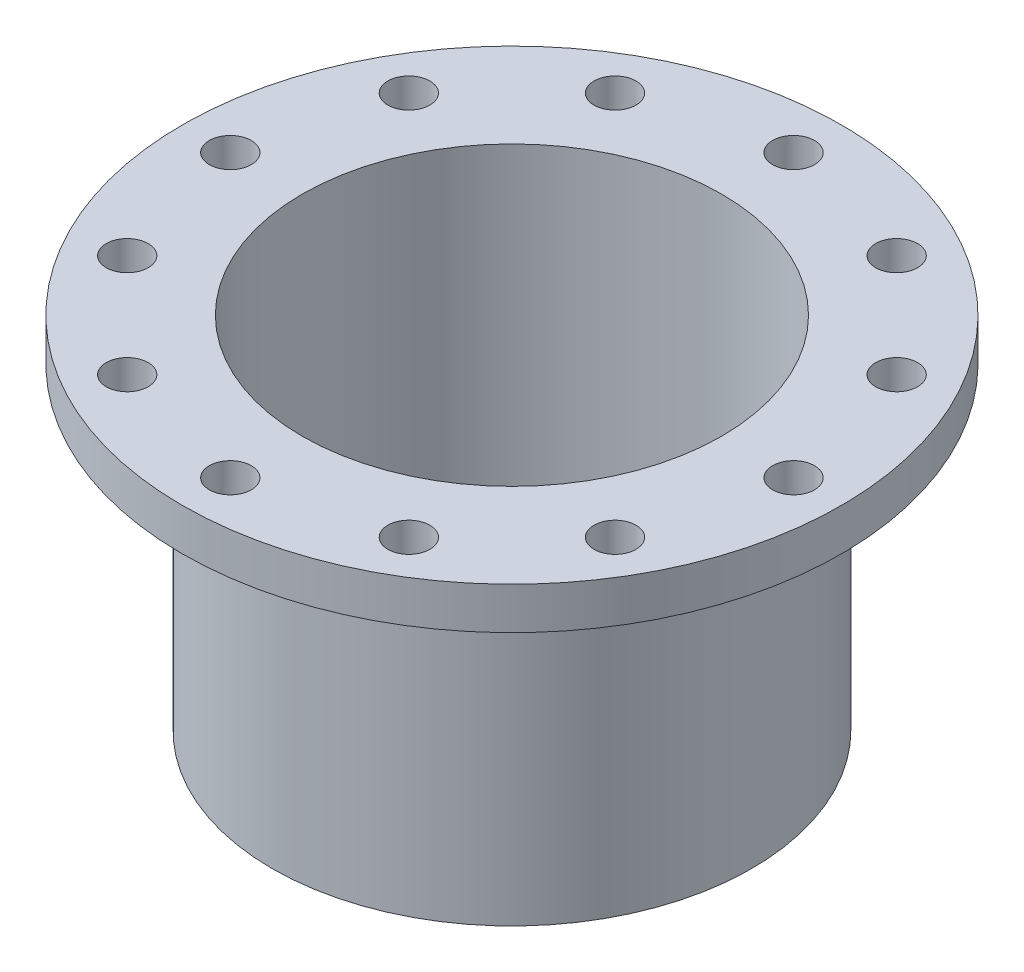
SolidWorks part; units mm, degrees
ref_plane "Front Plane" through (0, 0, 0) normal (0, 0, 1) x (1, 0, 0)
ref_plane "Top Plane" through (0, 0, 0) normal (0, 1, 0) x (1, 0, 0)
ref_plane "Right Plane" through (0, 0, 0) normal (1, 0, 0) x (0, 0, -1)
sketch "Sketch1" plane through (0, 0, 0) normal (0, 1, 0) x (1, 0, 0)
  circle A0 centre (0, 0) radius 175
  circle A1 centre (0, 0) radius 200
  dimension "Bore Dia" = 350
  dimension "Hub Dia" = 400
extrude "Boss-Extrude1" add sketch "Sketch1" along normal blind 300
sketch "Sketch2" plane through (0, 300, 0) normal (0, 1, 0) x (1, 0, 0)
  circle A0 centre (0, 0) radius 175
  circle A1 centre (0, 0) radius 275
  circle A2 centre (0, 0) radius 175 construction
  dimension "Flange Dia" = 550
extrude "Boss-Extrude2" add sketch "Sketch2" against normal blind 35
sketch "Sketch3" plane through (0, 300, 0) normal (0, 1, 0) x (1, 0, 0)
  circle A0 centre (0, 0) radius 235 construction
  circle A1 centre (0, 235) radius 17.5
  dimension "Hole Dia" = 35
  dimension "PCD" = 470
extrude "Cut-Extrude1" cut sketch "Sketch3" against normal up to next
pattern_circular "CirPattern1" count 12 over 360 about axis through (0, 0, 0) along (0, 1, 0) of "Cut-Extrude1"
